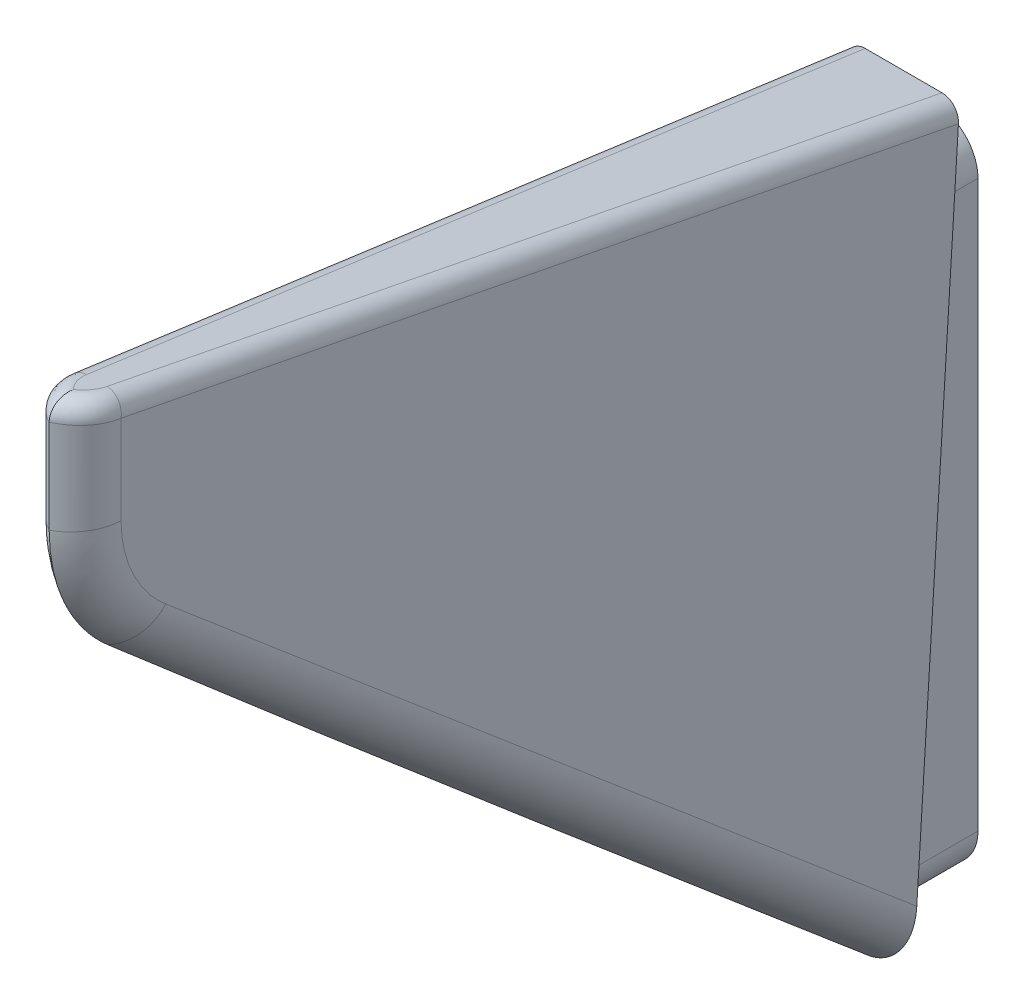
SolidWorks part; units mm, degrees
ref_plane "Plan de face" through (0, 0, 0) normal (0, 0, 1) x (1, 0, 0)
ref_plane "Plan de dessus" through (0, 0, 0) normal (0, 1, 0) x (1, 0, 0)
ref_plane "Plan de droite" through (0, 0, 0) normal (1, 0, 0) x (0, 0, -1)
sketch "Esquisse1" plane through (0, 0, 0) normal (0, 0, 1) x (1, 0, 0)
  line L1 (-2, 15) -> (2, 15)
  line L2 (-2, 15) -> (-2, -15)
  line L3 (-2, -15) -> (2, -15)
  line L4 (2, 15) -> (2, -15)
  dimension "D1" = 30
  dimension "D2" = 4
  dimension "D3" = 2
  dimension "D4" = 15
extrude "Boss.-Extru.1" add sketch "Esquisse1" against normal blind 3.5
fillet "Congé1" radius 2 4 edges at (-2, 15, -1.75) (2, 15, -1.75) (-2, -15, -1.75) (2, -15, -1.75)
sketch "Esquisse4" plane through (0, 0, 0) normal (1, 0, 0) x (0, 0, -1)
  line L0 (0, -13) -> (0, 13) construction
  line L1 (0, -17) -> (2.0795, 17)
  line L2 (-37.5, 23.6233) -> (-37.5, 18.3419)
  line L4 (2.0795, 17) -> (-37.5, 23.6233)
  line L6 (0, -17) -> (-34.6573, 12.2261)
  arc A0 (-34.6573, 12.2261) -> (-37.5, 18.3419) centre (-29.5, 18.3419) cw
  point P9 (-37.5, 14.6233)
  dimension "D6" = 8
  dimension "D1" = 37.5
  dimension "D2" = 34
  dimension "D3" = 4
  dimension "D4" = 9
  dimension "D5" = 3.5
  dimension "D7" = 96
extrude "Boss.-Extru.2" add sketch "Esquisse4" along normal mid plane 5 contours L6 A0 L2 L4 L1
draft "Dépouille4" type of draft neutral plane draft angle 2 neutral plane "Plan de face" faces to draft 2 parameters "D1"=2
fillet "Congé2" radius 2.4 6 edges at (-1.8949, -2.3869, 17.3287) (1.8949, -2.3869, 17.3287) (-1.1905, 20.9826, 37.5) (-1.2165, 14.9698, 36.7546) (1.1905, 20.9826, 37.5) (1.2165, 14.9698, 36.7546)
fillet "Congé4" radius 0.8 4 edges at (-1.922, 20.1179, 16.5521) (1.922, 20.1179, 16.5521) (-0.9083, 23.4345, 36.3716) (0.9083, 23.4345, 36.3716)
scale "Echelle1" scale about centroid uniform scaling yes scale factor 1.25
